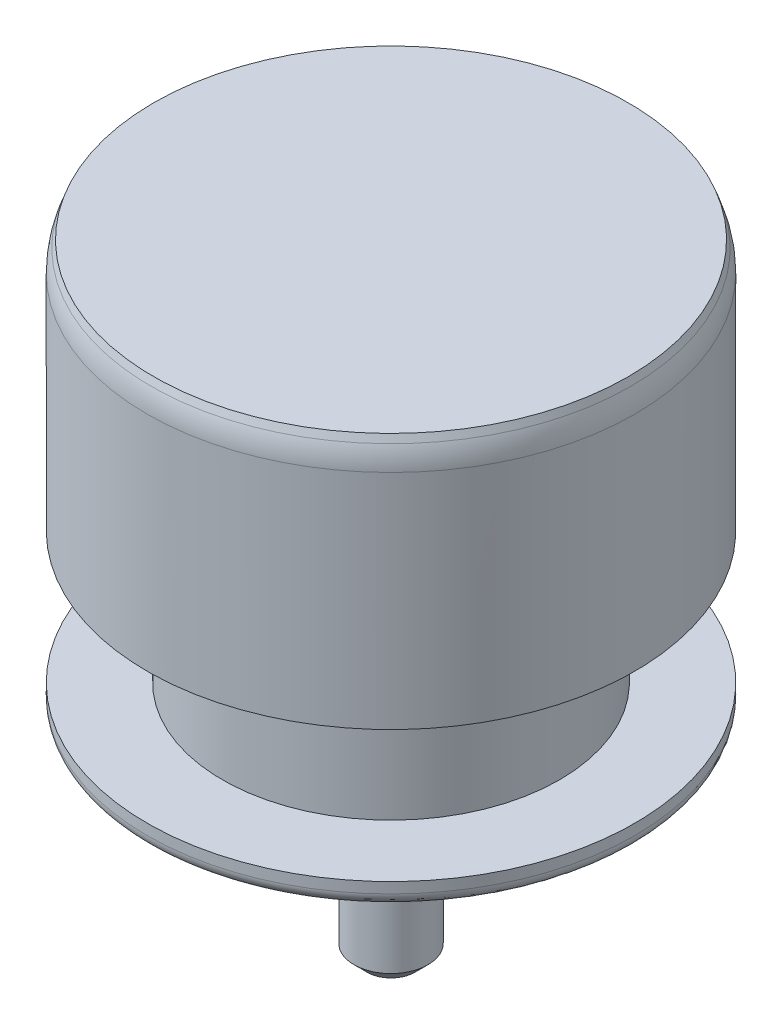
SolidWorks part; units mm, degrees
ref_plane "X_Y" through (0, 0, 0) normal (0, 0, 1) x (1, 0, 0)
ref_plane "Z_X" through (0, 0, 0) normal (0, 1, 0) x (1, 0, 0)
ref_plane "Y_Z" through (0, 0, 0) normal (1, 0, 0) x (0, 0, -1)
sketch "Sketch1" plane through (0, 0, 0) normal (0, 0, 1) x (1, 0, 0)
  line L0 (0, 0) -> (0, -9.6)
  line L2 (0.57, -7.8969) -> (3.76, -6.2008)
  line L3 (3.76, -6.2008) -> (3.76, -5.915)
  line L4 (3.76, -5.915) -> (2.6, -5.915)
  line L5 (2.6, -5.915) -> (2.6, -3.885)
  line L6 (2.6, -3.885) -> (3.76, -3.885)
  line L7 (3.76, -3.885) -> (3.76, -0.2747)
  line L8 (3.66, 0) -> (0, 0)
  line L10 (3.66, 0) -> (3.76, -0.2747)
  line L11 (0, -0.986) -> (0, -50000.986) construction
  line L12 (0.57, -7.8969) -> (0.57, -9.6)
  line L13 (0.57, -9.6) -> (0, -9.6)
  point P10 (0, -8.2)
  point P11 (2.6, -4.9)
  dimension "D1" = 6.2008
  dimension "D2" = 7.52
  dimension "D3" = 118
  dimension "D4" = 4.9
  dimension "D5" = 2.03
  dimension "D6" = 5.2
  dimension "D7" = 1.14
  dimension "D8" = 0.1
  dimension "D9" = 20
  dimension "D10" = 8.2
  dimension "D11" = 9.6
  dimension "D12" = 1.4
  dimension "D13" = 0.2858
revolve "Revolve1" add sketch "Sketch1" angle 360 about L0
fillet "Fillet1" radius 0.2 1 edges at (-3.76, -6.2008, 0)
fillet "Fillet2" radius 1 1 edges at (-3.76, -0.2747, 0)
chamfer "Chamfer1" distance 0.2 angle 45 1 edges at (-0.57, -9.6, 0)
